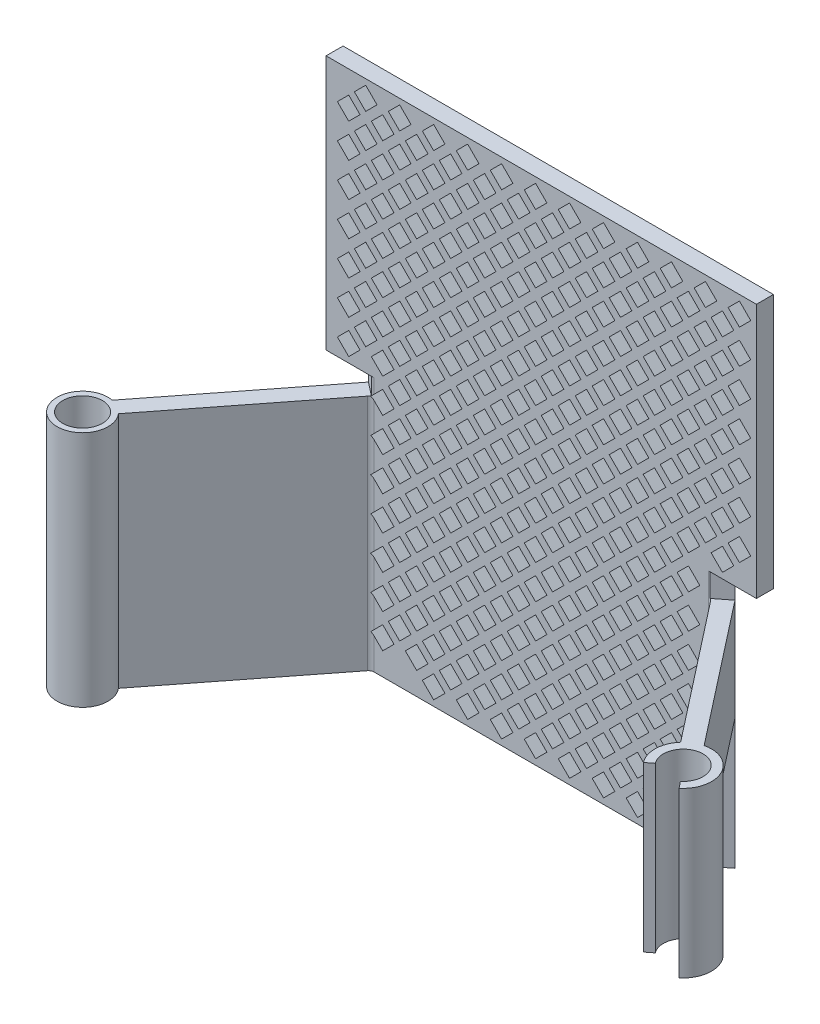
SolidWorks part; units mm, degrees
ref_plane "Plano frontal" through (0, 0, 0) normal (0, 0, 1) x (1, 0, 0)
ref_plane "Plano superior" through (0, 0, 0) normal (0, 1, 0) x (1, 0, 0)
ref_plane "Plano direito" through (0, 0, 0) normal (1, 0, 0) x (0, 0, -1)
sketch "Esboço2" plane through (0, 0, 0) normal (0, 1, 0) x (1, 0, 0)
  line L0 (0, 0) -> (0, 84) construction
  line L1 (-30, 84) -> (30, 84)
  line L2 (-29.5124, 81) -> (29.5124, 81)
  line L3 (-30, 84) -> (-30, 81) construction
  line L4 (30, 84) -> (30, 81) construction
  line L5 (30, 82.5) -> (53.033, 53.033) construction
  line L6 (30.3003, 80.6158) -> (49.279, 56.3356)
  line L8 (-30, 82.5) -> (-53.033, 53.033) construction
  line L9 (-30.3003, 80.6158) -> (-49.5929, 55.934)
  line L12 (50.2755, 50.8776) -> (49.0937, 49.9538)
  line L13 (55.2443, 50.32) -> (56.192, 49.1573)
  line L14 (30, 81) -> (32.3636, 82.8475) construction
  line L15 (32.3636, 82.8475) -> (51.8676, 57.8953)
  line L16 (-52.2101, 57.4571) -> (-32.3636, 82.8475)
  line L17 (-30, 81) -> (-32.3636, 82.8475) construction
  arc A0 (-53.033, 53.033) -> (53.033, 53.033) centre (0, 0) cw construction
  circle A1 centre (-53.033, 53.033) radius 3.5
  arc A2 (-52.2101, 57.4571) -> (-49.5929, 55.934) centre (-53.033, 53.033) ccw
  arc A3 (55.2443, 50.32) -> (50.2755, 50.8776) centre (53.033, 53.033) ccw
  arc A4 (56.192, 49.1573) -> (51.8676, 57.8953) centre (53.033, 53.033) ccw
  circle A5 centre (0, 0) radius 90 construction
  arc A6 (49.279, 56.3356) -> (49.0937, 49.9538) centre (53.033, 53.033) ccw
  arc A7 (-29.5124, 81) -> (-30.3003, 80.6158) centre (-29.5124, 80) ccw
  arc A8 (29.5124, 81) -> (30.3003, 80.6158) centre (29.5124, 80) cw
  arc A9 (-32.3636, 82.8475) -> (-30, 84) centre (-29.5124, 80) cw
  arc A10 (30, 84) -> (32.3636, 82.8475) centre (29.5124, 80) cw
  point P4 (0, 75)
  point P15 (0, 84)
  dimension "D1" = 75
  dimension "D3" = 7
  dimension "D4" = 9
  dimension "D5" = 10
  dimension "D6" = 7
  dimension "D7" = 180
  dimension "D15" = 1
  dimension "D2" = 90
  dimension "D8" = 84
  dimension "D9" = 60
  dimension "D10" = 81
  dimension "D11" = 5
  dimension "D12" = 30
  dimension "D13" = 3
  dimension "D14" = 3
  dimension "D16" = 90
extrude "Ressalto-extrusão1" add sketch "Esboço2" along normal blind 45
sketch "Esboço3" plane through (60.2872, 0, -47.1238) normal (0.7879, 0, -0.6158) x (-0.6158, 0, -0.7879)
  line L1 (45.3422, 45) -> (45.3422, 0) construction
  line L2 (45.3422, 23) -> (45.3422, 0)
  line L3 (45.3422, 0) -> (20.3422, 0)
  line L4 (45.3422, 23) -> (20.3422, 23)
  line L5 (20.3422, 23) -> (20.3422, 12)
  line L12 (20.3422, 0) -> (13.6717, 0)
  line L13 (13.6717, 0) -> (13.6717, 12)
  line L15 (13.6717, 45) -> (13.6717, 0) construction
  line L16 (13.6717, 12) -> (20.3422, 12)
  dimension "D1" = 23
  dimension "D2" = 25
  dimension "D3" = 12
extrude "Corte-extrusão1" cut sketch "Esboço3" against normal through all
sketch "Esboço4" plane through (60.2872, 0, -47.1238) normal (0.7879, 0, -0.6158) x (-0.6158, 0, -0.7879)
  line L0 (13.6717, 12) -> (4.1242, 12)
  line L1 (13.6717, 45) -> (13.6717, 12) construction
  line L2 (4.1242, 45) -> (4.1242, 0) construction
  line L3 (4.1242, 12) -> (4.1242, 0)
  line L4 (4.1242, 0) -> (13.6717, 0)
  line L5 (13.6717, 0) -> (13.6717, 12)
  line L7 (4.1242, 0) -> (13.6717, 0) construction
  dimension "D1" = 0
  dimension "D2" = 12
extrude "Corte-extrusão3" cut sketch "Esboço4" against normal mid plane 20
sketch "Esboço5" plane through (-60.2872, 0, -47.1238) normal (-0.7879, 0, -0.6158) x (-0.6158, 0, 0.7879)
  line L0 (-45.3422, 45) -> (-45.3422, 42)
  line L1 (-45.3422, 45) -> (-45.3422, 0) construction
  line L2 (-45.3422, 42) -> (-4.6231, 42)
  line L3 (-4.6231, 0) -> (-4.6231, 45) construction
  line L4 (-4.6231, 42) -> (-4.6231, 45)
  line L5 (-4.6231, 45) -> (-45.3422, 45)
  dimension "D1" = 3
extrude "Corte-extrusão4" cut sketch "Esboço5" against normal mid plane 20
sketch "Esboço6" plane through (60.2872, 0, -47.1238) normal (0.7879, 0, -0.6158) x (-0.6158, 0, -0.7879)
  line L0 (45.3422, 45) -> (4.1242, 45)
  line L1 (4.1242, 45) -> (4.1242, 41)
  line L2 (4.1242, 45) -> (4.1242, 12) construction
  line L3 (4.1242, 41) -> (45.3422, 41)
  line L4 (45.3422, 45) -> (45.3422, 23) construction
  line L5 (45.3422, 41) -> (45.3422, 45)
  dimension "D1" = 4
extrude "Corte-extrusão5" cut sketch "Esboço6" against normal mid plane 20
sketch "Esboço9" plane through (0, 45, 0) normal (0, 1, 0) x (1, 0, 0)
  line L0 (-30, 84) -> (-38, 84)
  line L1 (-29.5124, 81) -> (-38, 81)
  line L2 (-29.5124, 81) -> (29.5124, 81) construction
  line L3 (-38, 81) -> (-38, 84)
  line L4 (-30, 84) -> (30, 84)
  line L5 (30, 84) -> (38, 84)
  line L6 (-29.5124, 81) -> (38, 81)
  line L7 (38, 81) -> (38, 84)
  arc A0 (-29.5124, 81) -> (-29.9, 80.9218) centre (-29.5124, 80) ccw construction
  dimension "D1" = 8
  dimension "D2" = 8
extrude "Ressalto-extrusão2" add sketch "Esboço9" along normal blind 45
sketch "Esboço10" plane through (0, 0, -84) normal (0, 0, -1) x (-1, 0, 0)
  line L0 (-35, 89) -> (-37, 87)
  line L1 (-37, 87) -> (-35, 85)
  line L2 (-35, 85) -> (-33, 87)
  line L3 (-33, 87) -> (-35, 89)
  line L4 (-38, 90) -> (-38, 45) construction
  line L5 (-38, 90) -> (38, 90) construction
  line L6 (-35, 89) -> (-35, 85) construction
  line L7 (-31, 87) -> (-29, 85)
  line L8 (-29, 85) -> (-27, 87)
  line L9 (-27, 87) -> (-29, 89)
  line L10 (-29, 89) -> (-31, 87)
  line L11 (-25, 87) -> (-23, 85)
  line L12 (-23, 85) -> (-21, 87)
  line L13 (-21, 87) -> (-23, 89)
  line L14 (-23, 89) -> (-25, 87)
  line L15 (-19, 87) -> (-17, 85)
  line L16 (-17, 85) -> (-15, 87)
  line L17 (-15, 87) -> (-17, 89)
  line L18 (-17, 89) -> (-19, 87)
  line L19 (-13, 87) -> (-11, 85)
  line L20 (-11, 85) -> (-9, 87)
  line L21 (-9, 87) -> (-11, 89)
  line L22 (-11, 89) -> (-13, 87)
  line L23 (-7, 87) -> (-5, 85)
  line L24 (-5, 85) -> (-3, 87)
  line L25 (-3, 87) -> (-5, 89)
  line L26 (-5, 89) -> (-7, 87)
  line L27 (-1, 87) -> (1, 85)
  line L28 (1, 85) -> (3, 87)
  line L29 (3, 87) -> (1, 89)
  line L30 (1, 89) -> (-1, 87)
  line L31 (5, 87) -> (7, 85)
  line L32 (7, 85) -> (9, 87)
  line L33 (9, 87) -> (7, 89)
  line L34 (7, 89) -> (5, 87)
  line L35 (11, 87) -> (13, 85)
  line L36 (13, 85) -> (15, 87)
  line L37 (15, 87) -> (13, 89)
  line L38 (13, 89) -> (11, 87)
  line L39 (17, 87) -> (19, 85)
  line L40 (19, 85) -> (21, 87)
  line L41 (21, 87) -> (19, 89)
  line L42 (19, 89) -> (17, 87)
  line L43 (23, 87) -> (25, 85)
  line L44 (25, 85) -> (27, 87)
  line L45 (27, 87) -> (25, 89)
  line L46 (25, 89) -> (23, 87)
  line L47 (29, 87) -> (31, 85)
  line L48 (31, 85) -> (33, 87)
  line L49 (33, 87) -> (31, 89)
  line L50 (31, 89) -> (29, 87)
  line L51 (-31, 81) -> (-29, 79)
  line L52 (-29, 79) -> (-27, 81)
  line L53 (-27, 81) -> (-29, 83)
  line L54 (-29, 83) -> (-31, 81)
  line L55 (-25, 81) -> (-23, 79)
  line L56 (-23, 79) -> (-21, 81)
  line L57 (-21, 81) -> (-23, 83)
  line L58 (-23, 83) -> (-25, 81)
  line L59 (-19, 81) -> (-17, 79)
  line L60 (-17, 79) -> (-15, 81)
  line L61 (-15, 81) -> (-17, 83)
  line L62 (-17, 83) -> (-19, 81)
  line L63 (-13, 81) -> (-11, 79)
  line L64 (-11, 79) -> (-9, 81)
  line L65 (-9, 81) -> (-11, 83)
  line L66 (-11, 83) -> (-13, 81)
  line L67 (-7, 81) -> (-5, 79)
  line L68 (-5, 79) -> (-3, 81)
  line L69 (-3, 81) -> (-5, 83)
  line L70 (-5, 83) -> (-7, 81)
  line L71 (-1, 81) -> (1, 79)
  line L72 (1, 79) -> (3, 81)
  line L73 (3, 81) -> (1, 83)
  line L74 (1, 83) -> (-1, 81)
  line L75 (5, 81) -> (7, 79)
  line L76 (7, 79) -> (9, 81)
  line L77 (9, 81) -> (7, 83)
  line L78 (7, 83) -> (5, 81)
  line L79 (11, 81) -> (13, 79)
  line L80 (13, 79) -> (15, 81)
  line L81 (15, 81) -> (13, 83)
  line L82 (13, 83) -> (11, 81)
  line L83 (17, 81) -> (19, 79)
  line L84 (19, 79) -> (21, 81)
  line L85 (21, 81) -> (19, 83)
  line L86 (19, 83) -> (17, 81)
  line L87 (23, 81) -> (25, 79)
  line L88 (25, 79) -> (27, 81)
  line L89 (27, 81) -> (25, 83)
  line L90 (25, 83) -> (23, 81)
  line L91 (29, 81) -> (31, 79)
  line L92 (31, 79) -> (33, 81)
  line L93 (33, 81) -> (31, 83)
  line L94 (31, 83) -> (29, 81)
  line L95 (-31, 75) -> (-29, 73)
  line L96 (-29, 73) -> (-27, 75)
  line L97 (-27, 75) -> (-29, 77)
  line L98 (-29, 77) -> (-31, 75)
  line L99 (-25, 75) -> (-23, 73)
  line L100 (-23, 73) -> (-21, 75)
  line L101 (-21, 75) -> (-23, 77)
  line L102 (-23, 77) -> (-25, 75)
  line L103 (-19, 75) -> (-17, 73)
  line L104 (-17, 73) -> (-15, 75)
  line L105 (-15, 75) -> (-17, 77)
  line L106 (-17, 77) -> (-19, 75)
  line L107 (-13, 75) -> (-11, 73)
  line L108 (-11, 73) -> (-9, 75)
  line L109 (-9, 75) -> (-11, 77)
  line L110 (-11, 77) -> (-13, 75)
  line L111 (-7, 75) -> (-5, 73)
  line L112 (-5, 73) -> (-3, 75)
  line L113 (-3, 75) -> (-5, 77)
  line L114 (-5, 77) -> (-7, 75)
  line L115 (-1, 75) -> (1, 73)
  line L116 (1, 73) -> (3, 75)
  line L117 (3, 75) -> (1, 77)
  line L118 (1, 77) -> (-1, 75)
  line L119 (5, 75) -> (7, 73)
  line L120 (7, 73) -> (9, 75)
  line L121 (9, 75) -> (7, 77)
  line L122 (7, 77) -> (5, 75)
  line L123 (11, 75) -> (13, 73)
  line L124 (13, 73) -> (15, 75)
  line L125 (15, 75) -> (13, 77)
  line L126 (13, 77) -> (11, 75)
  line L127 (17, 75) -> (19, 73)
  line L128 (19, 73) -> (21, 75)
  line L129 (21, 75) -> (19, 77)
  line L130 (19, 77) -> (17, 75)
  line L131 (23, 75) -> (25, 73)
  line L132 (25, 73) -> (27, 75)
  line L133 (27, 75) -> (25, 77)
  line L134 (25, 77) -> (23, 75)
  line L135 (29, 75) -> (31, 73)
  line L136 (31, 73) -> (33, 75)
  line L137 (33, 75) -> (31, 77)
  line L138 (31, 77) -> (29, 75)
  line L139 (-31, 69) -> (-29, 67)
  line L140 (-29, 67) -> (-27, 69)
  line L141 (-27, 69) -> (-29, 71)
  line L142 (-29, 71) -> (-31, 69)
  line L143 (-25, 69) -> (-23, 67)
  line L144 (-23, 67) -> (-21, 69)
  line L145 (-21, 69) -> (-23, 71)
  line L146 (-23, 71) -> (-25, 69)
  line L147 (-19, 69) -> (-17, 67)
  line L148 (-17, 67) -> (-15, 69)
  line L149 (-15, 69) -> (-17, 71)
  line L150 (-17, 71) -> (-19, 69)
  line L151 (-13, 69) -> (-11, 67)
  line L152 (-11, 67) -> (-9, 69)
  line L153 (-9, 69) -> (-11, 71)
  line L154 (-11, 71) -> (-13, 69)
  line L155 (-7, 69) -> (-5, 67)
  line L156 (-5, 67) -> (-3, 69)
  line L157 (-3, 69) -> (-5, 71)
  line L158 (-5, 71) -> (-7, 69)
  line L159 (-1, 69) -> (1, 67)
  line L160 (1, 67) -> (3, 69)
  line L161 (3, 69) -> (1, 71)
  line L162 (1, 71) -> (-1, 69)
  line L163 (5, 69) -> (7, 67)
  line L164 (7, 67) -> (9, 69)
  line L165 (9, 69) -> (7, 71)
  line L166 (7, 71) -> (5, 69)
  line L167 (11, 69) -> (13, 67)
  line L168 (13, 67) -> (15, 69)
  line L169 (15, 69) -> (13, 71)
  line L170 (13, 71) -> (11, 69)
  line L171 (17, 69) -> (19, 67)
  line L172 (19, 67) -> (21, 69)
  line L173 (21, 69) -> (19, 71)
  line L174 (19, 71) -> (17, 69)
  line L175 (23, 69) -> (25, 67)
  line L176 (25, 67) -> (27, 69)
  line L177 (27, 69) -> (25, 71)
  line L178 (25, 71) -> (23, 69)
  line L179 (29, 69) -> (31, 67)
  line L180 (31, 67) -> (33, 69)
  line L181 (33, 69) -> (31, 71)
  line L182 (31, 71) -> (29, 69)
  line L183 (-31, 63) -> (-29, 61)
  line L184 (-29, 61) -> (-27, 63)
  line L185 (-27, 63) -> (-29, 65)
  line L186 (-29, 65) -> (-31, 63)
  line L187 (-25, 63) -> (-23, 61)
  line L188 (-23, 61) -> (-21, 63)
  line L189 (-21, 63) -> (-23, 65)
  line L190 (-23, 65) -> (-25, 63)
  line L191 (-19, 63) -> (-17, 61)
  line L192 (-17, 61) -> (-15, 63)
  line L193 (-15, 63) -> (-17, 65)
  line L194 (-17, 65) -> (-19, 63)
  line L195 (-13, 63) -> (-11, 61)
  line L196 (-11, 61) -> (-9, 63)
  line L197 (-9, 63) -> (-11, 65)
  line L198 (-11, 65) -> (-13, 63)
  line L199 (-7, 63) -> (-5, 61)
  line L200 (-5, 61) -> (-3, 63)
  line L201 (-3, 63) -> (-5, 65)
  line L202 (-5, 65) -> (-7, 63)
  line L203 (-1, 63) -> (1, 61)
  line L204 (1, 61) -> (3, 63)
  line L205 (3, 63) -> (1, 65)
  line L206 (1, 65) -> (-1, 63)
  line L207 (5, 63) -> (7, 61)
  line L208 (7, 61) -> (9, 63)
  line L209 (9, 63) -> (7, 65)
  line L210 (7, 65) -> (5, 63)
  line L211 (11, 63) -> (13, 61)
  line L212 (13, 61) -> (15, 63)
  line L213 (15, 63) -> (13, 65)
  line L214 (13, 65) -> (11, 63)
  line L215 (17, 63) -> (19, 61)
  line L216 (19, 61) -> (21, 63)
  line L217 (21, 63) -> (19, 65)
  line L218 (19, 65) -> (17, 63)
  line L219 (23, 63) -> (25, 61)
  line L220 (25, 61) -> (27, 63)
  line L221 (27, 63) -> (25, 65)
  line L222 (25, 65) -> (23, 63)
  line L223 (29, 63) -> (31, 61)
  line L224 (31, 61) -> (33, 63)
  line L225 (33, 63) -> (31, 65)
  line L226 (31, 65) -> (29, 63)
  line L227 (-31, 57) -> (-29, 55)
  line L228 (-29, 55) -> (-27, 57)
  line L229 (-27, 57) -> (-29, 59)
  line L230 (-29, 59) -> (-31, 57)
  line L231 (-25, 57) -> (-23, 55)
  line L232 (-23, 55) -> (-21, 57)
  line L233 (-21, 57) -> (-23, 59)
  line L234 (-23, 59) -> (-25, 57)
  line L235 (-19, 57) -> (-17, 55)
  line L236 (-17, 55) -> (-15, 57)
  line L237 (-15, 57) -> (-17, 59)
  line L238 (-17, 59) -> (-19, 57)
  line L239 (-13, 57) -> (-11, 55)
  line L240 (-11, 55) -> (-9, 57)
  line L241 (-9, 57) -> (-11, 59)
  line L242 (-11, 59) -> (-13, 57)
  line L243 (-7, 57) -> (-5, 55)
  line L244 (-5, 55) -> (-3, 57)
  line L245 (-3, 57) -> (-5, 59)
  line L246 (-5, 59) -> (-7, 57)
  line L247 (-1, 57) -> (1, 55)
  line L248 (1, 55) -> (3, 57)
  line L249 (3, 57) -> (1, 59)
  line L250 (1, 59) -> (-1, 57)
  line L251 (5, 57) -> (7, 55)
  line L252 (7, 55) -> (9, 57)
  line L253 (9, 57) -> (7, 59)
  line L254 (7, 59) -> (5, 57)
  line L255 (11, 57) -> (13, 55)
  line L256 (13, 55) -> (15, 57)
  line L257 (15, 57) -> (13, 59)
  line L258 (13, 59) -> (11, 57)
  line L259 (17, 57) -> (19, 55)
  line L260 (19, 55) -> (21, 57)
  line L261 (21, 57) -> (19, 59)
  line L262 (19, 59) -> (17, 57)
  line L263 (23, 57) -> (25, 55)
  line L264 (25, 55) -> (27, 57)
  line L265 (27, 57) -> (25, 59)
  line L266 (25, 59) -> (23, 57)
  line L267 (29, 57) -> (31, 55)
  line L268 (31, 55) -> (33, 57)
  line L269 (33, 57) -> (31, 59)
  line L270 (31, 59) -> (29, 57)
  line L271 (-31, 51) -> (-29, 49)
  line L272 (-29, 49) -> (-27, 51)
  line L273 (-27, 51) -> (-29, 53)
  line L274 (-29, 53) -> (-31, 51)
  line L275 (-25, 51) -> (-23, 49)
  line L276 (-23, 49) -> (-21, 51)
  line L277 (-21, 51) -> (-23, 53)
  line L278 (-23, 53) -> (-25, 51)
  line L279 (-19, 51) -> (-17, 49)
  line L280 (-17, 49) -> (-15, 51)
  line L281 (-15, 51) -> (-17, 53)
  line L282 (-17, 53) -> (-19, 51)
  line L283 (-13, 51) -> (-11, 49)
  line L284 (-11, 49) -> (-9, 51)
  line L285 (-9, 51) -> (-11, 53)
  line L286 (-11, 53) -> (-13, 51)
  line L287 (-7, 51) -> (-5, 49)
  line L288 (-5, 49) -> (-3, 51)
  line L289 (-3, 51) -> (-5, 53)
  line L290 (-5, 53) -> (-7, 51)
  line L291 (-1, 51) -> (1, 49)
  line L292 (1, 49) -> (3, 51)
  line L293 (3, 51) -> (1, 53)
  line L294 (1, 53) -> (-1, 51)
  line L295 (5, 51) -> (7, 49)
  line L296 (7, 49) -> (9, 51)
  line L297 (9, 51) -> (7, 53)
  line L298 (7, 53) -> (5, 51)
  line L299 (11, 51) -> (13, 49)
  line L300 (13, 49) -> (15, 51)
  line L301 (15, 51) -> (13, 53)
  line L302 (13, 53) -> (11, 51)
  line L303 (17, 51) -> (19, 49)
  line L304 (19, 49) -> (21, 51)
  line L305 (21, 51) -> (19, 53)
  line L306 (19, 53) -> (17, 51)
  line L307 (23, 51) -> (25, 49)
  line L308 (25, 49) -> (27, 51)
  line L309 (27, 51) -> (25, 53)
  line L310 (25, 53) -> (23, 51)
  line L311 (29, 51) -> (31, 49)
  line L312 (31, 49) -> (33, 51)
  line L313 (33, 51) -> (31, 53)
  line L314 (31, 53) -> (29, 51)
  line L319 (-25, 45) -> (-23, 43)
  line L320 (-23, 43) -> (-21, 45)
  line L321 (-21, 45) -> (-23, 47)
  line L322 (-23, 47) -> (-25, 45)
  line L323 (-19, 45) -> (-17, 43)
  line L324 (-17, 43) -> (-15, 45)
  line L325 (-15, 45) -> (-17, 47)
  line L326 (-17, 47) -> (-19, 45)
  line L327 (-13, 45) -> (-11, 43)
  line L328 (-11, 43) -> (-9, 45)
  line L329 (-9, 45) -> (-11, 47)
  line L330 (-11, 47) -> (-13, 45)
  line L331 (-7, 45) -> (-5, 43)
  line L332 (-5, 43) -> (-3, 45)
  line L333 (-3, 45) -> (-5, 47)
  line L334 (-5, 47) -> (-7, 45)
  line L335 (-1, 45) -> (1, 43)
  line L336 (1, 43) -> (3, 45)
  line L337 (3, 45) -> (1, 47)
  line L338 (1, 47) -> (-1, 45)
  line L339 (5, 45) -> (7, 43)
  line L340 (7, 43) -> (9, 45)
  line L341 (9, 45) -> (7, 47)
  line L342 (7, 47) -> (5, 45)
  line L343 (11, 45) -> (13, 43)
  line L344 (13, 43) -> (15, 45)
  line L345 (15, 45) -> (13, 47)
  line L346 (13, 47) -> (11, 45)
  line L347 (17, 45) -> (19, 43)
  line L348 (19, 43) -> (21, 45)
  line L349 (21, 45) -> (19, 47)
  line L350 (19, 47) -> (17, 45)
  line L351 (23, 45) -> (25, 43)
  line L352 (25, 43) -> (27, 45)
  line L353 (27, 45) -> (25, 47)
  line L354 (25, 47) -> (23, 45)
  line L363 (-25, 39) -> (-23, 37)
  line L364 (-23, 37) -> (-21, 39)
  line L365 (-21, 39) -> (-23, 41)
  line L366 (-23, 41) -> (-25, 39)
  line L367 (-19, 39) -> (-17, 37)
  line L368 (-17, 37) -> (-15, 39)
  line L369 (-15, 39) -> (-17, 41)
  line L370 (-17, 41) -> (-19, 39)
  line L371 (-13, 39) -> (-11, 37)
  line L372 (-11, 37) -> (-9, 39)
  line L373 (-9, 39) -> (-11, 41)
  line L374 (-11, 41) -> (-13, 39)
  line L375 (-7, 39) -> (-5, 37)
  line L376 (-5, 37) -> (-3, 39)
  line L377 (-3, 39) -> (-5, 41)
  line L378 (-5, 41) -> (-7, 39)
  line L379 (-1, 39) -> (1, 37)
  line L380 (1, 37) -> (3, 39)
  line L381 (3, 39) -> (1, 41)
  line L382 (1, 41) -> (-1, 39)
  line L383 (5, 39) -> (7, 37)
  line L384 (7, 37) -> (9, 39)
  line L385 (9, 39) -> (7, 41)
  line L386 (7, 41) -> (5, 39)
  line L387 (11, 39) -> (13, 37)
  line L388 (13, 37) -> (15, 39)
  line L389 (15, 39) -> (13, 41)
  line L390 (13, 41) -> (11, 39)
  line L391 (17, 39) -> (19, 37)
  line L392 (19, 37) -> (21, 39)
  line L393 (21, 39) -> (19, 41)
  line L394 (19, 41) -> (17, 39)
  line L395 (23, 39) -> (25, 37)
  line L396 (25, 37) -> (27, 39)
  line L397 (27, 39) -> (25, 41)
  line L398 (25, 41) -> (23, 39)
  line L407 (-25, 33) -> (-23, 31)
  line L408 (-23, 31) -> (-21, 33)
  line L409 (-21, 33) -> (-23, 35)
  line L410 (-23, 35) -> (-25, 33)
  line L411 (-19, 33) -> (-17, 31)
  line L412 (-17, 31) -> (-15, 33)
  line L413 (-15, 33) -> (-17, 35)
  line L414 (-17, 35) -> (-19, 33)
  line L415 (-13, 33) -> (-11, 31)
  line L416 (-11, 31) -> (-9, 33)
  line L417 (-9, 33) -> (-11, 35)
  line L418 (-11, 35) -> (-13, 33)
  line L419 (-7, 33) -> (-5, 31)
  line L420 (-5, 31) -> (-3, 33)
  line L421 (-3, 33) -> (-5, 35)
  line L422 (-5, 35) -> (-7, 33)
  line L423 (-1, 33) -> (1, 31)
  line L424 (1, 31) -> (3, 33)
  line L425 (3, 33) -> (1, 35)
  line L426 (1, 35) -> (-1, 33)
  line L427 (5, 33) -> (7, 31)
  line L428 (7, 31) -> (9, 33)
  line L429 (9, 33) -> (7, 35)
  line L430 (7, 35) -> (5, 33)
  line L431 (11, 33) -> (13, 31)
  line L432 (13, 31) -> (15, 33)
  line L433 (15, 33) -> (13, 35)
  line L434 (13, 35) -> (11, 33)
  line L435 (17, 33) -> (19, 31)
  line L436 (19, 31) -> (21, 33)
  line L437 (21, 33) -> (19, 35)
  line L438 (19, 35) -> (17, 33)
  line L439 (23, 33) -> (25, 31)
  line L440 (25, 31) -> (27, 33)
  line L441 (27, 33) -> (25, 35)
  line L442 (25, 35) -> (23, 33)
  line L447 (-37, 81) -> (-35, 79)
  line L448 (-35, 79) -> (-33, 81)
  line L449 (-33, 81) -> (-35, 83)
  line L450 (-35, 83) -> (-37, 81)
  line L451 (-37, 75) -> (-35, 73)
  line L452 (-35, 73) -> (-33, 75)
  line L453 (-33, 75) -> (-35, 77)
  line L454 (-35, 77) -> (-37, 75)
  line L455 (-37, 69) -> (-35, 67)
  line L456 (-35, 67) -> (-33, 69)
  line L457 (-33, 69) -> (-35, 71)
  line L458 (-35, 71) -> (-37, 69)
  line L459 (-37, 63) -> (-35, 61)
  line L460 (-35, 61) -> (-33, 63)
  line L461 (-33, 63) -> (-35, 65)
  line L462 (-35, 65) -> (-37, 63)
  line L463 (-37, 57) -> (-35, 55)
  line L464 (-35, 55) -> (-33, 57)
  line L465 (-33, 57) -> (-35, 59)
  line L466 (-35, 59) -> (-37, 57)
  line L467 (-37, 51) -> (-35, 49)
  line L468 (-35, 49) -> (-33, 51)
  line L469 (-33, 51) -> (-35, 53)
  line L470 (-35, 53) -> (-37, 51)
  line L483 (-35, 83) -> (-35, 85) construction
  line L484 (-33, 87) -> (-31, 87) construction
  line L485 (-31, 87) -> (-32, 87) construction
  line L486 (-32, 87) -> (-32, 99) construction
  line L487 (-32, 86) -> (-34, 84)
  line L488 (-34, 84) -> (-32, 82)
  line L489 (-32, 82) -> (-30, 84)
  line L490 (-30, 84) -> (-32, 86)
  line L491 (-24, 84) -> (-26, 86)
  line L492 (-26, 82) -> (-24, 84)
  line L493 (-26, 86) -> (-28, 84)
  line L494 (-28, 84) -> (-26, 82)
  line L495 (-18, 84) -> (-20, 86)
  line L496 (-20, 82) -> (-18, 84)
  line L497 (-20, 86) -> (-22, 84)
  line L498 (-22, 84) -> (-20, 82)
  line L499 (-12, 84) -> (-14, 86)
  line L500 (-14, 82) -> (-12, 84)
  line L501 (-14, 86) -> (-16, 84)
  line L502 (-16, 84) -> (-14, 82)
  line L503 (-6, 84) -> (-8, 86)
  line L504 (-8, 82) -> (-6, 84)
  line L505 (-8, 86) -> (-10, 84)
  line L506 (-10, 84) -> (-8, 82)
  line L507 (0, 84) -> (-2, 86)
  line L508 (-2, 82) -> (0, 84)
  line L509 (-2, 86) -> (-4, 84)
  line L510 (-4, 84) -> (-2, 82)
  line L511 (6, 84) -> (4, 86)
  line L512 (4, 82) -> (6, 84)
  line L513 (4, 86) -> (2, 84)
  line L514 (2, 84) -> (4, 82)
  line L515 (12, 84) -> (10, 86)
  line L516 (10, 82) -> (12, 84)
  line L517 (10, 86) -> (8, 84)
  line L518 (8, 84) -> (10, 82)
  line L519 (18, 84) -> (16, 86)
  line L520 (16, 82) -> (18, 84)
  line L521 (16, 86) -> (14, 84)
  line L522 (14, 84) -> (16, 82)
  line L523 (24, 84) -> (22, 86)
  line L524 (22, 82) -> (24, 84)
  line L525 (22, 86) -> (20, 84)
  line L526 (20, 84) -> (22, 82)
  line L527 (30, 84) -> (28, 86)
  line L528 (28, 82) -> (30, 84)
  line L529 (28, 86) -> (26, 84)
  line L530 (26, 84) -> (28, 82)
  line L531 (36, 84) -> (34, 86)
  line L532 (34, 82) -> (36, 84)
  line L533 (34, 86) -> (32, 84)
  line L534 (32, 84) -> (34, 82)
  line L535 (-24, 78) -> (-26, 80)
  line L536 (-26, 76) -> (-24, 78)
  line L537 (-26, 80) -> (-28, 78)
  line L538 (-28, 78) -> (-26, 76)
  line L539 (-18, 78) -> (-20, 80)
  line L540 (-20, 76) -> (-18, 78)
  line L541 (-20, 80) -> (-22, 78)
  line L542 (-22, 78) -> (-20, 76)
  line L543 (-12, 78) -> (-14, 80)
  line L544 (-14, 76) -> (-12, 78)
  line L545 (-14, 80) -> (-16, 78)
  line L546 (-16, 78) -> (-14, 76)
  line L547 (-6, 78) -> (-8, 80)
  line L548 (-8, 76) -> (-6, 78)
  line L549 (-8, 80) -> (-10, 78)
  line L550 (-10, 78) -> (-8, 76)
  line L551 (0, 78) -> (-2, 80)
  line L552 (-2, 76) -> (0, 78)
  line L553 (-2, 80) -> (-4, 78)
  line L554 (-4, 78) -> (-2, 76)
  line L555 (6, 78) -> (4, 80)
  line L556 (4, 76) -> (6, 78)
  line L557 (4, 80) -> (2, 78)
  line L558 (2, 78) -> (4, 76)
  line L559 (12, 78) -> (10, 80)
  line L560 (10, 76) -> (12, 78)
  line L561 (10, 80) -> (8, 78)
  line L562 (8, 78) -> (10, 76)
  line L563 (18, 78) -> (16, 80)
  line L564 (16, 76) -> (18, 78)
  line L565 (16, 80) -> (14, 78)
  line L566 (14, 78) -> (16, 76)
  line L567 (24, 78) -> (22, 80)
  line L568 (22, 76) -> (24, 78)
  line L569 (22, 80) -> (20, 78)
  line L570 (20, 78) -> (22, 76)
  line L571 (30, 78) -> (28, 80)
  line L572 (28, 76) -> (30, 78)
  line L573 (28, 80) -> (26, 78)
  line L574 (26, 78) -> (28, 76)
  line L575 (36, 78) -> (34, 80)
  line L576 (34, 76) -> (36, 78)
  line L577 (34, 80) -> (32, 78)
  line L578 (32, 78) -> (34, 76)
  line L579 (-24, 72) -> (-26, 74)
  line L580 (-26, 70) -> (-24, 72)
  line L581 (-26, 74) -> (-28, 72)
  line L582 (-28, 72) -> (-26, 70)
  line L583 (-18, 72) -> (-20, 74)
  line L584 (-20, 70) -> (-18, 72)
  line L585 (-20, 74) -> (-22, 72)
  line L586 (-22, 72) -> (-20, 70)
  line L587 (-12, 72) -> (-14, 74)
  line L588 (-14, 70) -> (-12, 72)
  line L589 (-14, 74) -> (-16, 72)
  line L590 (-16, 72) -> (-14, 70)
  line L591 (-6, 72) -> (-8, 74)
  line L592 (-8, 70) -> (-6, 72)
  line L593 (-8, 74) -> (-10, 72)
  line L594 (-10, 72) -> (-8, 70)
  line L595 (0, 72) -> (-2, 74)
  line L596 (-2, 70) -> (0, 72)
  line L597 (-2, 74) -> (-4, 72)
  line L598 (-4, 72) -> (-2, 70)
  line L599 (6, 72) -> (4, 74)
  line L600 (4, 70) -> (6, 72)
  line L601 (4, 74) -> (2, 72)
  line L602 (2, 72) -> (4, 70)
  line L603 (12, 72) -> (10, 74)
  line L604 (10, 70) -> (12, 72)
  line L605 (10, 74) -> (8, 72)
  line L606 (8, 72) -> (10, 70)
  line L607 (18, 72) -> (16, 74)
  line L608 (16, 70) -> (18, 72)
  line L609 (16, 74) -> (14, 72)
  line L610 (14, 72) -> (16, 70)
  line L611 (24, 72) -> (22, 74)
  line L612 (22, 70) -> (24, 72)
  line L613 (22, 74) -> (20, 72)
  line L614 (20, 72) -> (22, 70)
  line L615 (30, 72) -> (28, 74)
  line L616 (28, 70) -> (30, 72)
  line L617 (28, 74) -> (26, 72)
  line L618 (26, 72) -> (28, 70)
  line L619 (36, 72) -> (34, 74)
  line L620 (34, 70) -> (36, 72)
  line L621 (34, 74) -> (32, 72)
  line L622 (32, 72) -> (34, 70)
  line L623 (-24, 66) -> (-26, 68)
  line L624 (-26, 64) -> (-24, 66)
  line L625 (-26, 68) -> (-28, 66)
  line L626 (-28, 66) -> (-26, 64)
  line L627 (-18, 66) -> (-20, 68)
  line L628 (-20, 64) -> (-18, 66)
  line L629 (-20, 68) -> (-22, 66)
  line L630 (-22, 66) -> (-20, 64)
  line L631 (-12, 66) -> (-14, 68)
  line L632 (-14, 64) -> (-12, 66)
  line L633 (-14, 68) -> (-16, 66)
  line L634 (-16, 66) -> (-14, 64)
  line L635 (-6, 66) -> (-8, 68)
  line L636 (-8, 64) -> (-6, 66)
  line L637 (-8, 68) -> (-10, 66)
  line L638 (-10, 66) -> (-8, 64)
  line L639 (0, 66) -> (-2, 68)
  line L640 (-2, 64) -> (0, 66)
  line L641 (-2, 68) -> (-4, 66)
  line L642 (-4, 66) -> (-2, 64)
  line L643 (6, 66) -> (4, 68)
  line L644 (4, 64) -> (6, 66)
  line L645 (4, 68) -> (2, 66)
  line L646 (2, 66) -> (4, 64)
  line L647 (12, 66) -> (10, 68)
  line L648 (10, 64) -> (12, 66)
  line L649 (10, 68) -> (8, 66)
  line L650 (8, 66) -> (10, 64)
  line L651 (18, 66) -> (16, 68)
  line L652 (16, 64) -> (18, 66)
  line L653 (16, 68) -> (14, 66)
  line L654 (14, 66) -> (16, 64)
  line L655 (24, 66) -> (22, 68)
  line L656 (22, 64) -> (24, 66)
  line L657 (22, 68) -> (20, 66)
  line L658 (20, 66) -> (22, 64)
  line L659 (30, 66) -> (28, 68)
  line L660 (28, 64) -> (30, 66)
  line L661 (28, 68) -> (26, 66)
  line L662 (26, 66) -> (28, 64)
  line L663 (36, 66) -> (34, 68)
  line L664 (34, 64) -> (36, 66)
  line L665 (34, 68) -> (32, 66)
  line L666 (32, 66) -> (34, 64)
  line L667 (-24, 60) -> (-26, 62)
  line L668 (-26, 58) -> (-24, 60)
  line L669 (-26, 62) -> (-28, 60)
  line L670 (-28, 60) -> (-26, 58)
  line L671 (-18, 60) -> (-20, 62)
  line L672 (-20, 58) -> (-18, 60)
  line L673 (-20, 62) -> (-22, 60)
  line L674 (-22, 60) -> (-20, 58)
  line L675 (-12, 60) -> (-14, 62)
  line L676 (-14, 58) -> (-12, 60)
  line L677 (-14, 62) -> (-16, 60)
  line L678 (-16, 60) -> (-14, 58)
  line L679 (-6, 60) -> (-8, 62)
  line L680 (-8, 58) -> (-6, 60)
  line L681 (-8, 62) -> (-10, 60)
  line L682 (-10, 60) -> (-8, 58)
  line L683 (0, 60) -> (-2, 62)
  line L684 (-2, 58) -> (0, 60)
  line L685 (-2, 62) -> (-4, 60)
  line L686 (-4, 60) -> (-2, 58)
  line L687 (6, 60) -> (4, 62)
  line L688 (4, 58) -> (6, 60)
  line L689 (4, 62) -> (2, 60)
  line L690 (2, 60) -> (4, 58)
  line L691 (12, 60) -> (10, 62)
  line L692 (10, 58) -> (12, 60)
  line L693 (10, 62) -> (8, 60)
  line L694 (8, 60) -> (10, 58)
  line L695 (18, 60) -> (16, 62)
  line L696 (16, 58) -> (18, 60)
  line L697 (16, 62) -> (14, 60)
  line L698 (14, 60) -> (16, 58)
  line L699 (24, 60) -> (22, 62)
  line L700 (22, 58) -> (24, 60)
  line L701 (22, 62) -> (20, 60)
  line L702 (20, 60) -> (22, 58)
  line L703 (30, 60) -> (28, 62)
  line L704 (28, 58) -> (30, 60)
  line L705 (28, 62) -> (26, 60)
  line L706 (26, 60) -> (28, 58)
  line L707 (36, 60) -> (34, 62)
  line L708 (34, 58) -> (36, 60)
  line L709 (34, 62) -> (32, 60)
  line L710 (32, 60) -> (34, 58)
  line L711 (-24, 54) -> (-26, 56)
  line L712 (-26, 52) -> (-24, 54)
  line L713 (-26, 56) -> (-28, 54)
  line L714 (-28, 54) -> (-26, 52)
  line L715 (-18, 54) -> (-20, 56)
  line L716 (-20, 52) -> (-18, 54)
  line L717 (-20, 56) -> (-22, 54)
  line L718 (-22, 54) -> (-20, 52)
  line L719 (-12, 54) -> (-14, 56)
  line L720 (-14, 52) -> (-12, 54)
  line L721 (-14, 56) -> (-16, 54)
  line L722 (-16, 54) -> (-14, 52)
  line L723 (-6, 54) -> (-8, 56)
  line L724 (-8, 52) -> (-6, 54)
  line L725 (-8, 56) -> (-10, 54)
  line L726 (-10, 54) -> (-8, 52)
  line L727 (0, 54) -> (-2, 56)
  line L728 (-2, 52) -> (0, 54)
  line L729 (-2, 56) -> (-4, 54)
  line L730 (-4, 54) -> (-2, 52)
  line L731 (6, 54) -> (4, 56)
  line L732 (4, 52) -> (6, 54)
  line L733 (4, 56) -> (2, 54)
  line L734 (2, 54) -> (4, 52)
  line L735 (12, 54) -> (10, 56)
  line L736 (10, 52) -> (12, 54)
  line L737 (10, 56) -> (8, 54)
  line L738 (8, 54) -> (10, 52)
  line L739 (18, 54) -> (16, 56)
  line L740 (16, 52) -> (18, 54)
  line L741 (16, 56) -> (14, 54)
  line L742 (14, 54) -> (16, 52)
  line L743 (24, 54) -> (22, 56)
  line L744 (22, 52) -> (24, 54)
  line L745 (22, 56) -> (20, 54)
  line L746 (20, 54) -> (22, 52)
  line L747 (30, 54) -> (28, 56)
  line L748 (28, 52) -> (30, 54)
  line L749 (28, 56) -> (26, 54)
  line L750 (26, 54) -> (28, 52)
  line L751 (36, 54) -> (34, 56)
  line L752 (34, 52) -> (36, 54)
  line L753 (34, 56) -> (32, 54)
  line L754 (32, 54) -> (34, 52)
  line L755 (-24, 48) -> (-26, 50)
  line L756 (-26, 46) -> (-24, 48)
  line L757 (-26, 50) -> (-28, 48)
  line L758 (-28, 48) -> (-26, 46)
  line L759 (-18, 48) -> (-20, 50)
  line L760 (-20, 46) -> (-18, 48)
  line L761 (-20, 50) -> (-22, 48)
  line L762 (-22, 48) -> (-20, 46)
  line L763 (-12, 48) -> (-14, 50)
  line L764 (-14, 46) -> (-12, 48)
  line L765 (-14, 50) -> (-16, 48)
  line L766 (-16, 48) -> (-14, 46)
  line L767 (-6, 48) -> (-8, 50)
  line L768 (-8, 46) -> (-6, 48)
  line L769 (-8, 50) -> (-10, 48)
  line L770 (-10, 48) -> (-8, 46)
  line L771 (0, 48) -> (-2, 50)
  line L772 (-2, 46) -> (0, 48)
  line L773 (-2, 50) -> (-4, 48)
  line L774 (-4, 48) -> (-2, 46)
  line L775 (6, 48) -> (4, 50)
  line L776 (4, 46) -> (6, 48)
  line L777 (4, 50) -> (2, 48)
  line L778 (2, 48) -> (4, 46)
  line L779 (12, 48) -> (10, 50)
  line L780 (10, 46) -> (12, 48)
  line L781 (10, 50) -> (8, 48)
  line L782 (8, 48) -> (10, 46)
  line L783 (18, 48) -> (16, 50)
  line L784 (16, 46) -> (18, 48)
  line L785 (16, 50) -> (14, 48)
  line L786 (14, 48) -> (16, 46)
  line L787 (24, 48) -> (22, 50)
  line L788 (22, 46) -> (24, 48)
  line L789 (22, 50) -> (20, 48)
  line L790 (20, 48) -> (22, 46)
  line L791 (30, 48) -> (28, 50)
  line L792 (28, 46) -> (30, 48)
  line L793 (28, 50) -> (26, 48)
  line L794 (26, 48) -> (28, 46)
  line L795 (36, 48) -> (34, 50)
  line L796 (34, 46) -> (36, 48)
  line L797 (34, 50) -> (32, 48)
  line L798 (32, 48) -> (34, 46)
  line L799 (-24, 42) -> (-26, 44)
  line L800 (-26, 40) -> (-24, 42)
  line L801 (-26, 44) -> (-28, 42)
  line L802 (-28, 42) -> (-26, 40)
  line L803 (-18, 42) -> (-20, 44)
  line L804 (-20, 40) -> (-18, 42)
  line L805 (-20, 44) -> (-22, 42)
  line L806 (-22, 42) -> (-20, 40)
  line L807 (-12, 42) -> (-14, 44)
  line L808 (-14, 40) -> (-12, 42)
  line L809 (-14, 44) -> (-16, 42)
  line L810 (-16, 42) -> (-14, 40)
  line L811 (-6, 42) -> (-8, 44)
  line L812 (-8, 40) -> (-6, 42)
  line L813 (-8, 44) -> (-10, 42)
  line L814 (-10, 42) -> (-8, 40)
  line L815 (0, 42) -> (-2, 44)
  line L816 (-2, 40) -> (0, 42)
  line L817 (-2, 44) -> (-4, 42)
  line L818 (-4, 42) -> (-2, 40)
  line L819 (6, 42) -> (4, 44)
  line L820 (4, 40) -> (6, 42)
  line L821 (4, 44) -> (2, 42)
  line L822 (2, 42) -> (4, 40)
  line L823 (12, 42) -> (10, 44)
  line L824 (10, 40) -> (12, 42)
  line L825 (10, 44) -> (8, 42)
  line L826 (8, 42) -> (10, 40)
  line L827 (18, 42) -> (16, 44)
  line L828 (16, 40) -> (18, 42)
  line L829 (16, 44) -> (14, 42)
  line L830 (14, 42) -> (16, 40)
  line L831 (24, 42) -> (22, 44)
  line L832 (22, 40) -> (24, 42)
  line L833 (22, 44) -> (20, 42)
  line L834 (20, 42) -> (22, 40)
  line L835 (30, 42) -> (28, 44)
  line L836 (28, 40) -> (30, 42)
  line L837 (28, 44) -> (26, 42)
  line L838 (26, 42) -> (28, 40)
  line L843 (-24, 36) -> (-26, 38)
  line L844 (-26, 34) -> (-24, 36)
  line L845 (-26, 38) -> (-28, 36)
  line L846 (-28, 36) -> (-26, 34)
  line L847 (-18, 36) -> (-20, 38)
  line L848 (-20, 34) -> (-18, 36)
  line L849 (-20, 38) -> (-22, 36)
  line L850 (-22, 36) -> (-20, 34)
  line L851 (-12, 36) -> (-14, 38)
  line L852 (-14, 34) -> (-12, 36)
  line L853 (-14, 38) -> (-16, 36)
  line L854 (-16, 36) -> (-14, 34)
  line L855 (-6, 36) -> (-8, 38)
  line L856 (-8, 34) -> (-6, 36)
  line L857 (-8, 38) -> (-10, 36)
  line L858 (-10, 36) -> (-8, 34)
  line L859 (0, 36) -> (-2, 38)
  line L860 (-2, 34) -> (0, 36)
  line L861 (-2, 38) -> (-4, 36)
  line L862 (-4, 36) -> (-2, 34)
  line L863 (6, 36) -> (4, 38)
  line L864 (4, 34) -> (6, 36)
  line L865 (4, 38) -> (2, 36)
  line L866 (2, 36) -> (4, 34)
  line L867 (12, 36) -> (10, 38)
  line L868 (10, 34) -> (12, 36)
  line L869 (10, 38) -> (8, 36)
  line L870 (8, 36) -> (10, 34)
  line L871 (18, 36) -> (16, 38)
  line L872 (16, 34) -> (18, 36)
  line L873 (16, 38) -> (14, 36)
  line L874 (14, 36) -> (16, 34)
  line L875 (24, 36) -> (22, 38)
  line L876 (22, 34) -> (24, 36)
  line L877 (22, 38) -> (20, 36)
  line L878 (20, 36) -> (22, 34)
  line L879 (30, 36) -> (28, 38)
  line L880 (28, 34) -> (30, 36)
  line L881 (28, 38) -> (26, 36)
  line L882 (26, 36) -> (28, 34)
  line L887 (-30, 78) -> (-32, 80)
  line L888 (-32, 76) -> (-30, 78)
  line L889 (-32, 80) -> (-34, 78)
  line L890 (-34, 78) -> (-32, 76)
  line L891 (-30, 72) -> (-32, 74)
  line L892 (-32, 70) -> (-30, 72)
  line L893 (-32, 74) -> (-34, 72)
  line L894 (-34, 72) -> (-32, 70)
  line L895 (-30, 66) -> (-32, 68)
  line L896 (-32, 64) -> (-30, 66)
  line L897 (-32, 68) -> (-34, 66)
  line L898 (-34, 66) -> (-32, 64)
  line L899 (-30, 60) -> (-32, 62)
  line L900 (-32, 58) -> (-30, 60)
  line L901 (-32, 62) -> (-34, 60)
  line L902 (-34, 60) -> (-32, 58)
  line L903 (-30, 54) -> (-32, 56)
  line L904 (-32, 52) -> (-30, 54)
  line L905 (-32, 56) -> (-34, 54)
  line L906 (-34, 54) -> (-32, 52)
  line L907 (-30, 48) -> (-32, 50)
  line L908 (-32, 46) -> (-30, 48)
  line L909 (-32, 50) -> (-34, 48)
  line L910 (-34, 48) -> (-32, 46)
  line L919 (-19, 33) -> (-17, 31)
  line L920 (-17, 31) -> (-15, 33)
  line L921 (-15, 33) -> (-17, 35)
  line L922 (-17, 35) -> (-19, 33)
  line L923 (-13, 33) -> (-11, 31)
  line L924 (-11, 31) -> (-9, 33)
  line L925 (-9, 33) -> (-11, 35)
  line L926 (-11, 35) -> (-13, 33)
  line L927 (-7, 33) -> (-5, 31)
  line L928 (-5, 31) -> (-3, 33)
  line L929 (-3, 33) -> (-5, 35)
  line L930 (-5, 35) -> (-7, 33)
  line L931 (-1, 33) -> (1, 31)
  line L932 (1, 31) -> (3, 33)
  line L933 (3, 33) -> (1, 35)
  line L934 (1, 35) -> (-1, 33)
  line L935 (5, 33) -> (7, 31)
  line L936 (7, 31) -> (9, 33)
  line L937 (9, 33) -> (7, 35)
  line L938 (7, 35) -> (5, 33)
  line L939 (11, 33) -> (13, 31)
  line L940 (13, 31) -> (15, 33)
  line L941 (15, 33) -> (13, 35)
  line L942 (13, 35) -> (11, 33)
  line L943 (17, 33) -> (19, 31)
  line L944 (19, 31) -> (21, 33)
  line L945 (21, 33) -> (19, 35)
  line L946 (19, 35) -> (17, 33)
  line L947 (23, 33) -> (25, 31)
  line L948 (25, 31) -> (27, 33)
  line L949 (27, 33) -> (25, 35)
  line L950 (25, 35) -> (23, 33)
  line L951 (-19, 27) -> (-17, 25)
  line L952 (-17, 25) -> (-15, 27)
  line L953 (-15, 27) -> (-17, 29)
  line L954 (-17, 29) -> (-19, 27)
  line L955 (-13, 27) -> (-11, 25)
  line L956 (-11, 25) -> (-9, 27)
  line L957 (-9, 27) -> (-11, 29)
  line L958 (-11, 29) -> (-13, 27)
  line L959 (-7, 27) -> (-5, 25)
  line L960 (-5, 25) -> (-3, 27)
  line L961 (-3, 27) -> (-5, 29)
  line L962 (-5, 29) -> (-7, 27)
  line L963 (-1, 27) -> (1, 25)
  line L964 (1, 25) -> (3, 27)
  line L965 (3, 27) -> (1, 29)
  line L966 (1, 29) -> (-1, 27)
  line L967 (5, 27) -> (7, 25)
  line L968 (7, 25) -> (9, 27)
  line L969 (9, 27) -> (7, 29)
  line L970 (7, 29) -> (5, 27)
  line L971 (11, 27) -> (13, 25)
  line L972 (13, 25) -> (15, 27)
  line L973 (15, 27) -> (13, 29)
  line L974 (13, 29) -> (11, 27)
  line L975 (17, 27) -> (19, 25)
  line L976 (19, 25) -> (21, 27)
  line L977 (21, 27) -> (19, 29)
  line L978 (19, 29) -> (17, 27)
  line L979 (23, 27) -> (25, 25)
  line L980 (25, 25) -> (27, 27)
  line L981 (27, 27) -> (25, 29)
  line L982 (25, 29) -> (23, 27)
  line L983 (-19, 21) -> (-17, 19)
  line L984 (-17, 19) -> (-15, 21)
  line L985 (-15, 21) -> (-17, 23)
  line L986 (-17, 23) -> (-19, 21)
  line L987 (-13, 21) -> (-11, 19)
  line L988 (-11, 19) -> (-9, 21)
  line L989 (-9, 21) -> (-11, 23)
  line L990 (-11, 23) -> (-13, 21)
  line L991 (-7, 21) -> (-5, 19)
  line L992 (-5, 19) -> (-3, 21)
  line L993 (-3, 21) -> (-5, 23)
  line L994 (-5, 23) -> (-7, 21)
  line L995 (-1, 21) -> (1, 19)
  line L996 (1, 19) -> (3, 21)
  line L997 (3, 21) -> (1, 23)
  line L998 (1, 23) -> (-1, 21)
  line L999 (5, 21) -> (7, 19)
  line L1000 (7, 19) -> (9, 21)
  line L1001 (9, 21) -> (7, 23)
  line L1002 (7, 23) -> (5, 21)
  line L1003 (11, 21) -> (13, 19)
  line L1004 (13, 19) -> (15, 21)
  line L1005 (15, 21) -> (13, 23)
  line L1006 (13, 23) -> (11, 21)
  line L1007 (17, 21) -> (19, 19)
  line L1008 (19, 19) -> (21, 21)
  line L1009 (21, 21) -> (19, 23)
  line L1010 (19, 23) -> (17, 21)
  line L1011 (23, 21) -> (25, 19)
  line L1012 (25, 19) -> (27, 21)
  line L1013 (27, 21) -> (25, 23)
  line L1014 (25, 23) -> (23, 21)
  line L1015 (-19, 15) -> (-17, 13)
  line L1016 (-17, 13) -> (-15, 15)
  line L1017 (-15, 15) -> (-17, 17)
  line L1018 (-17, 17) -> (-19, 15)
  line L1019 (-13, 15) -> (-11, 13)
  line L1020 (-11, 13) -> (-9, 15)
  line L1021 (-9, 15) -> (-11, 17)
  line L1022 (-11, 17) -> (-13, 15)
  line L1023 (-7, 15) -> (-5, 13)
  line L1024 (-5, 13) -> (-3, 15)
  line L1025 (-3, 15) -> (-5, 17)
  line L1026 (-5, 17) -> (-7, 15)
  line L1027 (-1, 15) -> (1, 13)
  line L1028 (1, 13) -> (3, 15)
  line L1029 (3, 15) -> (1, 17)
  line L1030 (1, 17) -> (-1, 15)
  line L1031 (5, 15) -> (7, 13)
  line L1032 (7, 13) -> (9, 15)
  line L1033 (9, 15) -> (7, 17)
  line L1034 (7, 17) -> (5, 15)
  line L1035 (11, 15) -> (13, 13)
  line L1036 (13, 13) -> (15, 15)
  line L1037 (15, 15) -> (13, 17)
  line L1038 (13, 17) -> (11, 15)
  line L1039 (17, 15) -> (19, 13)
  line L1040 (19, 13) -> (21, 15)
  line L1041 (21, 15) -> (19, 17)
  line L1042 (19, 17) -> (17, 15)
  line L1043 (23, 15) -> (25, 13)
  line L1044 (25, 13) -> (27, 15)
  line L1045 (27, 15) -> (25, 17)
  line L1046 (25, 17) -> (23, 15)
  line L1047 (-19, 9) -> (-17, 7)
  line L1048 (-17, 7) -> (-15, 9)
  line L1049 (-15, 9) -> (-17, 11)
  line L1050 (-17, 11) -> (-19, 9)
  line L1051 (-13, 9) -> (-11, 7)
  line L1052 (-11, 7) -> (-9, 9)
  line L1053 (-9, 9) -> (-11, 11)
  line L1054 (-11, 11) -> (-13, 9)
  line L1055 (-7, 9) -> (-5, 7)
  line L1056 (-5, 7) -> (-3, 9)
  line L1057 (-3, 9) -> (-5, 11)
  line L1058 (-5, 11) -> (-7, 9)
  line L1059 (-1, 9) -> (1, 7)
  line L1060 (1, 7) -> (3, 9)
  line L1061 (3, 9) -> (1, 11)
  line L1062 (1, 11) -> (-1, 9)
  line L1063 (5, 9) -> (7, 7)
  line L1064 (7, 7) -> (9, 9)
  line L1065 (9, 9) -> (7, 11)
  line L1066 (7, 11) -> (5, 9)
  line L1067 (11, 9) -> (13, 7)
  line L1068 (13, 7) -> (15, 9)
  line L1069 (15, 9) -> (13, 11)
  line L1070 (13, 11) -> (11, 9)
  line L1071 (17, 9) -> (19, 7)
  line L1072 (19, 7) -> (21, 9)
  line L1073 (21, 9) -> (19, 11)
  line L1074 (19, 11) -> (17, 9)
  line L1075 (23, 9) -> (25, 7)
  line L1076 (25, 7) -> (27, 9)
  line L1077 (27, 9) -> (25, 11)
  line L1078 (25, 11) -> (23, 9)
  line L1079 (-19, 3) -> (-17, 1)
  line L1080 (-17, 1) -> (-15, 3)
  line L1081 (-15, 3) -> (-17, 5)
  line L1082 (-17, 5) -> (-19, 3)
  line L1083 (-13, 3) -> (-11, 1)
  line L1084 (-11, 1) -> (-9, 3)
  line L1085 (-9, 3) -> (-11, 5)
  line L1086 (-11, 5) -> (-13, 3)
  line L1087 (-7, 3) -> (-5, 1)
  line L1088 (-5, 1) -> (-3, 3)
  line L1089 (-3, 3) -> (-5, 5)
  line L1090 (-5, 5) -> (-7, 3)
  line L1091 (-1, 3) -> (1, 1)
  line L1092 (1, 1) -> (3, 3)
  line L1093 (3, 3) -> (1, 5)
  line L1094 (1, 5) -> (-1, 3)
  line L1095 (5, 3) -> (7, 1)
  line L1096 (7, 1) -> (9, 3)
  line L1097 (9, 3) -> (7, 5)
  line L1098 (7, 5) -> (5, 3)
  line L1099 (11, 3) -> (13, 1)
  line L1100 (13, 1) -> (15, 3)
  line L1101 (15, 3) -> (13, 5)
  line L1102 (13, 5) -> (11, 3)
  line L1103 (17, 3) -> (19, 1)
  line L1104 (19, 1) -> (21, 3)
  line L1105 (21, 3) -> (19, 5)
  line L1106 (19, 5) -> (17, 3)
  line L1175 (-25, 27) -> (-23, 25)
  line L1176 (-23, 25) -> (-21, 27)
  line L1177 (-21, 27) -> (-23, 29)
  line L1178 (-23, 29) -> (-25, 27)
  line L1179 (-25, 21) -> (-23, 19)
  line L1180 (-23, 19) -> (-21, 21)
  line L1181 (-21, 21) -> (-23, 23)
  line L1182 (-23, 23) -> (-25, 21)
  line L1183 (-25, 15) -> (-23, 13)
  line L1184 (-23, 13) -> (-21, 15)
  line L1185 (-21, 15) -> (-23, 17)
  line L1186 (-23, 17) -> (-25, 15)
  line L1187 (-25, 9) -> (-23, 7)
  line L1188 (-23, 7) -> (-21, 9)
  line L1189 (-21, 9) -> (-23, 11)
  line L1190 (-23, 11) -> (-25, 9)
  line L1191 (-25, 3) -> (-23, 1)
  line L1192 (-23, 1) -> (-21, 3)
  line L1193 (-21, 3) -> (-23, 5)
  line L1194 (-23, 5) -> (-25, 3)
  line L1203 (-22, 36) -> (-20, 34)
  line L1204 (-20, 34) -> (-18, 36)
  line L1205 (-18, 36) -> (-20, 38)
  line L1206 (-20, 38) -> (-22, 36)
  line L1207 (-16, 36) -> (-14, 34)
  line L1208 (-14, 34) -> (-12, 36)
  line L1209 (-12, 36) -> (-14, 38)
  line L1210 (-14, 38) -> (-16, 36)
  line L1211 (-10, 36) -> (-8, 34)
  line L1212 (-8, 34) -> (-6, 36)
  line L1213 (-6, 36) -> (-8, 38)
  line L1214 (-8, 38) -> (-10, 36)
  line L1215 (-4, 36) -> (-2, 34)
  line L1216 (-2, 34) -> (0, 36)
  line L1217 (0, 36) -> (-2, 38)
  line L1218 (-2, 38) -> (-4, 36)
  line L1219 (2, 36) -> (4, 34)
  line L1220 (4, 34) -> (6, 36)
  line L1221 (6, 36) -> (4, 38)
  line L1222 (4, 38) -> (2, 36)
  line L1223 (8, 36) -> (10, 34)
  line L1224 (10, 34) -> (12, 36)
  line L1225 (12, 36) -> (10, 38)
  line L1226 (10, 38) -> (8, 36)
  line L1227 (14, 36) -> (16, 34)
  line L1228 (16, 34) -> (18, 36)
  line L1229 (18, 36) -> (16, 38)
  line L1230 (16, 38) -> (14, 36)
  line L1231 (20, 36) -> (22, 34)
  line L1232 (22, 34) -> (24, 36)
  line L1233 (24, 36) -> (22, 38)
  line L1234 (22, 38) -> (20, 36)
  line L1235 (26, 36) -> (28, 34)
  line L1236 (28, 34) -> (30, 36)
  line L1237 (30, 36) -> (28, 38)
  line L1238 (28, 38) -> (26, 36)
  line L1239 (-22, 30) -> (-20, 28)
  line L1240 (-20, 28) -> (-18, 30)
  line L1241 (-18, 30) -> (-20, 32)
  line L1242 (-20, 32) -> (-22, 30)
  line L1243 (-16, 30) -> (-14, 28)
  line L1244 (-14, 28) -> (-12, 30)
  line L1245 (-12, 30) -> (-14, 32)
  line L1246 (-14, 32) -> (-16, 30)
  line L1247 (-10, 30) -> (-8, 28)
  line L1248 (-8, 28) -> (-6, 30)
  line L1249 (-6, 30) -> (-8, 32)
  line L1250 (-8, 32) -> (-10, 30)
  line L1251 (-4, 30) -> (-2, 28)
  line L1252 (-2, 28) -> (0, 30)
  line L1253 (0, 30) -> (-2, 32)
  line L1254 (-2, 32) -> (-4, 30)
  line L1255 (2, 30) -> (4, 28)
  line L1256 (4, 28) -> (6, 30)
  line L1257 (6, 30) -> (4, 32)
  line L1258 (4, 32) -> (2, 30)
  line L1259 (8, 30) -> (10, 28)
  line L1260 (10, 28) -> (12, 30)
  line L1261 (12, 30) -> (10, 32)
  line L1262 (10, 32) -> (8, 30)
  line L1263 (14, 30) -> (16, 28)
  line L1264 (16, 28) -> (18, 30)
  line L1265 (18, 30) -> (16, 32)
  line L1266 (16, 32) -> (14, 30)
  line L1267 (20, 30) -> (22, 28)
  line L1268 (22, 28) -> (24, 30)
  line L1269 (24, 30) -> (22, 32)
  line L1270 (22, 32) -> (20, 30)
  line L1271 (26, 30) -> (28, 28)
  line L1272 (28, 28) -> (30, 30)
  line L1273 (30, 30) -> (28, 32)
  line L1274 (28, 32) -> (26, 30)
  line L1275 (-22, 24) -> (-20, 22)
  line L1276 (-20, 22) -> (-18, 24)
  line L1277 (-18, 24) -> (-20, 26)
  line L1278 (-20, 26) -> (-22, 24)
  line L1279 (-16, 24) -> (-14, 22)
  line L1280 (-14, 22) -> (-12, 24)
  line L1281 (-12, 24) -> (-14, 26)
  line L1282 (-14, 26) -> (-16, 24)
  line L1283 (-10, 24) -> (-8, 22)
  line L1284 (-8, 22) -> (-6, 24)
  line L1285 (-6, 24) -> (-8, 26)
  line L1286 (-8, 26) -> (-10, 24)
  line L1287 (-4, 24) -> (-2, 22)
  line L1288 (-2, 22) -> (0, 24)
  line L1289 (0, 24) -> (-2, 26)
  line L1290 (-2, 26) -> (-4, 24)
  line L1291 (2, 24) -> (4, 22)
  line L1292 (4, 22) -> (6, 24)
  line L1293 (6, 24) -> (4, 26)
  line L1294 (4, 26) -> (2, 24)
  line L1295 (8, 24) -> (10, 22)
  line L1296 (10, 22) -> (12, 24)
  line L1297 (12, 24) -> (10, 26)
  line L1298 (10, 26) -> (8, 24)
  line L1299 (14, 24) -> (16, 22)
  line L1300 (16, 22) -> (18, 24)
  line L1301 (18, 24) -> (16, 26)
  line L1302 (16, 26) -> (14, 24)
  line L1303 (20, 24) -> (22, 22)
  line L1304 (22, 22) -> (24, 24)
  line L1305 (24, 24) -> (22, 26)
  line L1306 (22, 26) -> (20, 24)
  line L1307 (26, 24) -> (28, 22)
  line L1308 (28, 22) -> (30, 24)
  line L1309 (30, 24) -> (28, 26)
  line L1310 (28, 26) -> (26, 24)
  line L1311 (-22, 18) -> (-20, 16)
  line L1312 (-20, 16) -> (-18, 18)
  line L1313 (-18, 18) -> (-20, 20)
  line L1314 (-20, 20) -> (-22, 18)
  line L1315 (-16, 18) -> (-14, 16)
  line L1316 (-14, 16) -> (-12, 18)
  line L1317 (-12, 18) -> (-14, 20)
  line L1318 (-14, 20) -> (-16, 18)
  line L1319 (-10, 18) -> (-8, 16)
  line L1320 (-8, 16) -> (-6, 18)
  line L1321 (-6, 18) -> (-8, 20)
  line L1322 (-8, 20) -> (-10, 18)
  line L1323 (-4, 18) -> (-2, 16)
  line L1324 (-2, 16) -> (0, 18)
  line L1325 (0, 18) -> (-2, 20)
  line L1326 (-2, 20) -> (-4, 18)
  line L1327 (2, 18) -> (4, 16)
  line L1328 (4, 16) -> (6, 18)
  line L1329 (6, 18) -> (4, 20)
  line L1330 (4, 20) -> (2, 18)
  line L1331 (8, 18) -> (10, 16)
  line L1332 (10, 16) -> (12, 18)
  line L1333 (12, 18) -> (10, 20)
  line L1334 (10, 20) -> (8, 18)
  line L1335 (14, 18) -> (16, 16)
  line L1336 (16, 16) -> (18, 18)
  line L1337 (18, 18) -> (16, 20)
  line L1338 (16, 20) -> (14, 18)
  line L1339 (20, 18) -> (22, 16)
  line L1340 (22, 16) -> (24, 18)
  line L1341 (24, 18) -> (22, 20)
  line L1342 (22, 20) -> (20, 18)
  line L1343 (26, 18) -> (28, 16)
  line L1344 (28, 16) -> (30, 18)
  line L1345 (30, 18) -> (28, 20)
  line L1346 (28, 20) -> (26, 18)
  line L1347 (-22, 12) -> (-20, 10)
  line L1348 (-20, 10) -> (-18, 12)
  line L1349 (-18, 12) -> (-20, 14)
  line L1350 (-20, 14) -> (-22, 12)
  line L1351 (-16, 12) -> (-14, 10)
  line L1352 (-14, 10) -> (-12, 12)
  line L1353 (-12, 12) -> (-14, 14)
  line L1354 (-14, 14) -> (-16, 12)
  line L1355 (-10, 12) -> (-8, 10)
  line L1356 (-8, 10) -> (-6, 12)
  line L1357 (-6, 12) -> (-8, 14)
  line L1358 (-8, 14) -> (-10, 12)
  line L1359 (-4, 12) -> (-2, 10)
  line L1360 (-2, 10) -> (0, 12)
  line L1361 (0, 12) -> (-2, 14)
  line L1362 (-2, 14) -> (-4, 12)
  line L1363 (2, 12) -> (4, 10)
  line L1364 (4, 10) -> (6, 12)
  line L1365 (6, 12) -> (4, 14)
  line L1366 (4, 14) -> (2, 12)
  line L1367 (8, 12) -> (10, 10)
  line L1368 (10, 10) -> (12, 12)
  line L1369 (12, 12) -> (10, 14)
  line L1370 (10, 14) -> (8, 12)
  line L1371 (14, 12) -> (16, 10)
  line L1372 (16, 10) -> (18, 12)
  line L1373 (18, 12) -> (16, 14)
  line L1374 (16, 14) -> (14, 12)
  line L1375 (20, 12) -> (22, 10)
  line L1376 (22, 10) -> (24, 12)
  line L1377 (24, 12) -> (22, 14)
  line L1378 (22, 14) -> (20, 12)
  line L1379 (26, 12) -> (28, 10)
  line L1380 (28, 10) -> (30, 12)
  line L1381 (30, 12) -> (28, 14)
  line L1382 (28, 14) -> (26, 12)
  line L1383 (-22, 6) -> (-20, 4)
  line L1384 (-20, 4) -> (-18, 6)
  line L1385 (-18, 6) -> (-20, 8)
  line L1386 (-20, 8) -> (-22, 6)
  line L1387 (-16, 6) -> (-14, 4)
  line L1388 (-14, 4) -> (-12, 6)
  line L1389 (-12, 6) -> (-14, 8)
  line L1390 (-14, 8) -> (-16, 6)
  line L1391 (-10, 6) -> (-8, 4)
  line L1392 (-8, 4) -> (-6, 6)
  line L1393 (-6, 6) -> (-8, 8)
  line L1394 (-8, 8) -> (-10, 6)
  line L1395 (-4, 6) -> (-2, 4)
  line L1396 (-2, 4) -> (0, 6)
  line L1397 (0, 6) -> (-2, 8)
  line L1398 (-2, 8) -> (-4, 6)
  line L1399 (2, 6) -> (4, 4)
  line L1400 (4, 4) -> (6, 6)
  line L1401 (6, 6) -> (4, 8)
  line L1402 (4, 8) -> (2, 6)
  line L1403 (8, 6) -> (10, 4)
  line L1404 (10, 4) -> (12, 6)
  line L1405 (12, 6) -> (10, 8)
  line L1406 (10, 8) -> (8, 6)
  line L1407 (14, 6) -> (16, 4)
  line L1408 (16, 4) -> (18, 6)
  line L1409 (18, 6) -> (16, 8)
  line L1410 (16, 8) -> (14, 6)
  line L1411 (20, 6) -> (22, 4)
  line L1412 (22, 4) -> (24, 6)
  line L1413 (24, 6) -> (22, 8)
  line L1414 (22, 8) -> (20, 6)
  line L1415 (26, 6) -> (28, 4)
  line L1416 (28, 4) -> (30, 6)
  line L1417 (30, 6) -> (28, 8)
  line L1418 (28, 8) -> (26, 6)
  line L1527 (-28, 30) -> (-26, 28)
  line L1528 (-26, 28) -> (-24, 30)
  line L1529 (-24, 30) -> (-26, 32)
  line L1530 (-26, 32) -> (-28, 30)
  line L1531 (-28, 24) -> (-26, 22)
  line L1532 (-26, 22) -> (-24, 24)
  line L1533 (-24, 24) -> (-26, 26)
  line L1534 (-26, 26) -> (-28, 24)
  line L1535 (-28, 18) -> (-26, 16)
  line L1536 (-26, 16) -> (-24, 18)
  line L1537 (-24, 18) -> (-26, 20)
  line L1538 (-26, 20) -> (-28, 18)
  line L1539 (-28, 12) -> (-26, 10)
  line L1540 (-26, 10) -> (-24, 12)
  line L1541 (-24, 12) -> (-26, 14)
  line L1542 (-26, 14) -> (-28, 12)
  line L1543 (-28, 6) -> (-26, 4)
  line L1544 (-26, 4) -> (-24, 6)
  line L1545 (-24, 6) -> (-26, 8)
  line L1546 (-26, 8) -> (-28, 6)
  line L1559 (-37, 33) -> (-35, 31)
  line L1560 (-35, 31) -> (-33, 33)
  line L1561 (-33, 33) -> (-35, 35)
  line L1562 (-35, 35) -> (-37, 33)
  line L1563 (-37, 39) -> (-35, 37)
  line L1564 (-35, 41) -> (-37, 39)
  line L1565 (-37, 45) -> (-35, 43)
  line L1566 (-35, 47) -> (-37, 45)
  line L1567 (-33, 45) -> (-35, 47)
  line L1568 (-35, 43) -> (-33, 45)
  line L1569 (-32, 44) -> (-34, 42)
  line L1570 (-30, 42) -> (-32, 44)
  line L1571 (-34, 42) -> (-32, 40)
  line L1572 (-33, 39) -> (-35, 41)
  line L1573 (-32, 38) -> (-34, 36)
  line L1574 (-35, 37) -> (-33, 39)
  line L1575 (-34, 36) -> (-32, 34)
  line L1576 (-32, 34) -> (-30, 36)
  line L1577 (-29, 35) -> (-31, 33)
  line L1578 (-27, 33) -> (-29, 35)
  line L1579 (-31, 33) -> (-29, 31)
  line L1580 (-29, 31) -> (-27, 33)
  line L1581 (-30, 36) -> (-32, 38)
  line L1582 (-32, 40) -> (-30, 42)
  line L1583 (-31, 45) -> (-29, 43)
  line L1584 (-29, 47) -> (-31, 45)
  line L1585 (-27, 45) -> (-29, 47)
  line L1586 (-29, 43) -> (-27, 45)
  line L1587 (-29, 41) -> (-31, 39)
  line L1588 (-31, 39) -> (-29, 37)
  line L1589 (-29, 37) -> (-27, 39)
  line L1590 (-27, 39) -> (-29, 41)
  line L1591 (29, 33) -> (31, 31)
  line L1592 (31, 31) -> (33, 33)
  line L1593 (34, 34) -> (36, 36)
  line L1594 (32, 36) -> (34, 34)
  line L1595 (33, 33) -> (31, 35)
  line L1596 (31, 35) -> (29, 33)
  line L1597 (31, 37) -> (33, 39)
  line L1598 (31, 41) -> (29, 39)
  line L1599 (29, 39) -> (31, 37)
  line L1600 (34, 38) -> (32, 36)
  line L1601 (36, 36) -> (34, 38)
  line L1602 (32, 42) -> (34, 40)
  line L1603 (36, 42) -> (34, 44)
  line L1604 (34, 40) -> (36, 42)
  line L1605 (34, 44) -> (32, 42)
  line L1606 (31, 43) -> (33, 45)
  line L1607 (33, 45) -> (31, 47)
  line L1608 (31, 47) -> (29, 45)
  line L1609 (29, 45) -> (31, 43)
  line L1610 (33, 39) -> (31, 41)
  line L1611 (30, 0) -> (28, 2)
  line L1612 (28, 2) -> (26, 0)
  line L1613 (22, -2) -> (24, 0)
  line L1614 (20, 0) -> (22, -2)
  line L1615 (22, 2) -> (20, 0)
  line L1616 (24, 0) -> (22, 2)
  line L1617 (23, 3) -> (25, 1)
  line L1618 (25, 1) -> (27, 3)
  line L1619 (25, 5) -> (23, 3)
  line L1620 (27, 3) -> (25, 5)
  line L1621 (26, 0) -> (28, -2)
  line L1622 (27, -3) -> (25, -1)
  line L1623 (25, -5) -> (27, -3)
  line L1624 (27, -9) -> (25, -7)
  line L1625 (23, -9) -> (25, -11)
  line L1626 (24, -12) -> (22, -10)
  line L1627 (20, -12) -> (22, -14)
  line L1628 (16, -14) -> (18, -12)
  line L1629 (14, -12) -> (16, -14)
  line L1630 (10, -14) -> (12, -12)
  line L1631 (8, -12) -> (10, -14)
  line L1632 (4, -14) -> (6, -12)
  line L1633 (2, -12) -> (4, -14)
  line L1634 (-2, -14) -> (0, -12)
  line L1635 (-2, -10) -> (-4, -12)
  line L1636 (-6, -12) -> (-8, -10)
  line L1637 (-8, -10) -> (-10, -12)
  line L1638 (-12, -12) -> (-14, -10)
  line L1639 (-14, -10) -> (-16, -12)
  line L1640 (0, -12) -> (-2, -10)
  line L1641 (22, -14) -> (24, -12)
  line L1642 (26, -12) -> (28, -14)
  line L1643 (28, -14) -> (30, -12)
  line L1644 (28, -10) -> (26, -12)
  line L1645 (22, -10) -> (20, -12)
  line L1646 (18, -12) -> (16, -10)
  line L1647 (16, -10) -> (14, -12)
  line L1648 (13, -11) -> (15, -9)
  line L1649 (11, -9) -> (13, -11)
  line L1650 (12, -12) -> (10, -10)
  line L1651 (10, -10) -> (8, -12)
  line L1652 (7, -11) -> (9, -9)
  line L1653 (5, -9) -> (7, -11)
  line L1654 (1, -11) -> (3, -9)
  line L1655 (-1, -9) -> (1, -11)
  line L1656 (-5, -11) -> (-3, -9)
  line L1657 (-7, -9) -> (-5, -11)
  line L1658 (-11, -11) -> (-9, -9)
  line L1659 (1, -7) -> (-1, -9)
  line L1660 (3, -9) -> (1, -7)
  line L1661 (7, -7) -> (5, -9)
  line L1662 (9, -9) -> (7, -7)
  line L1663 (13, -7) -> (11, -9)
  line L1664 (15, -9) -> (13, -7)
  line L1665 (19, -7) -> (17, -9)
  line L1666 (21, -9) -> (19, -7)
  line L1667 (25, -7) -> (23, -9)
  line L1668 (28, -8) -> (30, -6)
  line L1669 (28, -4) -> (26, -6)
  line L1670 (24, -6) -> (22, -4)
  line L1671 (22, -4) -> (20, -6)
  line L1672 (19, -5) -> (21, -3)
  line L1673 (17, -3) -> (19, -5)
  line L1674 (18, -6) -> (16, -4)
  line L1675 (16, -4) -> (14, -6)
  line L1676 (12, -6) -> (10, -4)
  line L1677 (8, -6) -> (10, -8)
  line L1678 (4, -8) -> (6, -6)
  line L1679 (2, -6) -> (4, -8)
  line L1680 (-2, -8) -> (0, -6)
  line L1681 (-4, -6) -> (-2, -8)
  line L1682 (-3, -9) -> (-5, -7)
  line L1683 (-5, -7) -> (-7, -9)
  line L1684 (-8, -8) -> (-6, -6)
  line L1685 (-10, -6) -> (-8, -8)
  line L1686 (-14, -8) -> (-12, -6)
  line L1687 (-16, -6) -> (-14, -8)
  line L1688 (-12, -6) -> (-14, -4)
  line L1689 (-8, -4) -> (-10, -6)
  line L1690 (-6, -6) -> (-8, -4)
  line L1691 (-7, -3) -> (-5, -5)
  line L1692 (-5, -5) -> (-3, -3)
  line L1693 (-1, -3) -> (1, -5)
  line L1694 (1, -5) -> (3, -3)
  line L1695 (5, -3) -> (7, -5)
  line L1696 (7, -5) -> (9, -3)
  line L1697 (11, -3) -> (13, -5)
  line L1698 (13, -5) -> (15, -3)
  line L1699 (22, -8) -> (24, -6)
  line L1700 (26, -6) -> (28, -8)
  line L1701 (30, -6) -> (28, -4)
  line L1702 (30, -12) -> (28, -10)
  line L1703 (25, -11) -> (27, -9)
  line L1704 (16, -8) -> (18, -6)
  line L1705 (14, -6) -> (16, -8)
  line L1706 (10, -8) -> (12, -6)
  line L1707 (6, -12) -> (4, -10)
  line L1708 (-4, -12) -> (-2, -14)
  line L1709 (-8, -14) -> (-6, -12)
  line L1710 (-10, -12) -> (-8, -14)
  line L1711 (-14, -14) -> (-12, -12)
  line L1712 (-16, -12) -> (-14, -14)
  line L1713 (-13, -9) -> (-11, -11)
  line L1714 (-11, -7) -> (-13, -9)
  line L1715 (-9, -9) -> (-11, -7)
  line L1716 (4, -10) -> (2, -12)
  line L1717 (17, -9) -> (19, -11)
  line L1718 (19, -11) -> (21, -9)
  line L1719 (23, -3) -> (25, -5)
  line L1720 (25, -1) -> (23, -3)
  line L1721 (15, -3) -> (13, -1)
  line L1722 (19, -1) -> (17, -3)
  line L1723 (21, -3) -> (19, -1)
  line L1724 (28, -2) -> (30, 0)
  line L1725 (20, -6) -> (22, -8)
  line L1726 (16, -2) -> (18, 0)
  line L1727 (16, 2) -> (14, 0)
  line L1728 (18, 0) -> (16, 2)
  line L1729 (14, 0) -> (16, -2)
  line L1730 (13, -1) -> (11, -3)
  line L1731 (10, -2) -> (12, 0)
  line L1732 (8, 0) -> (10, -2)
  line L1733 (10, -4) -> (8, -6)
  line L1734 (7, -1) -> (5, -3)
  line L1735 (4, -2) -> (6, 0)
  line L1736 (6, -6) -> (4, -4)
  line L1737 (4, -4) -> (2, -6)
  line L1738 (0, -6) -> (-2, -4)
  line L1739 (-14, -4) -> (-16, -6)
  line L1740 (-13, -3) -> (-11, -5)
  line L1741 (-11, -5) -> (-9, -3)
  line L1742 (-5, -1) -> (-7, -3)
  line L1743 (1, -1) -> (-1, -3)
  line L1744 (-3, -3) -> (-5, -1)
  line L1745 (-8, -2) -> (-6, 0)
  line L1746 (-10, 0) -> (-8, -2)
  line L1747 (-9, -3) -> (-11, -1)
  line L1748 (-11, -1) -> (-13, -3)
  line L1749 (-14, -2) -> (-12, 0)
  line L1750 (-16, 0) -> (-14, -2)
  line L1751 (-15, -3) -> (-17, -1)
  line L1752 (-17, -1) -> (-19, -3)
  line L1753 (-14, 2) -> (-16, 0)
  line L1754 (-12, 0) -> (-14, 2)
  line L1755 (-8, 2) -> (-10, 0)
  line L1756 (-6, 0) -> (-8, 2)
  line L1757 (-2, 2) -> (-4, 0)
  line L1758 (-2, -2) -> (0, 0)
  line L1759 (2, 0) -> (4, -2)
  line L1760 (6, 0) -> (4, 2)
  line L1761 (4, 2) -> (2, 0)
  line L1762 (0, 0) -> (-2, 2)
  line L1763 (-4, 0) -> (-2, -2)
  line L1764 (3, -3) -> (1, -1)
  line L1765 (9, -3) -> (7, -1)
  line L1766 (10, 2) -> (8, 0)
  line L1767 (12, 0) -> (10, 2)
  line L1768 (-2, -4) -> (-4, -6)
  line L1769 (-20, -2) -> (-18, 0)
  line L1770 (-22, 0) -> (-20, -2)
  line L1771 (-26, -2) -> (-24, 0)
  line L1772 (-28, 0) -> (-26, -2)
  line L1773 (-26, 2) -> (-28, 0)
  line L1774 (-24, 0) -> (-26, 2)
  line L1775 (-20, 2) -> (-22, 0)
  line L1776 (-18, 0) -> (-20, 2)
  line L1777 (-17, -5) -> (-15, -3)
  line L1778 (-18, -6) -> (-20, -4)
  line L1779 (-20, -4) -> (-22, -6)
  line L1780 (-23, -5) -> (-21, -3)
  line L1781 (-25, -3) -> (-23, -5)
  line L1782 (-24, -6) -> (-26, -4)
  line L1783 (-26, -4) -> (-28, -6)
  line L1784 (-23, -7) -> (-25, -9)
  line L1785 (-21, -9) -> (-23, -7)
  line L1786 (-25, -9) -> (-23, -11)
  line L1787 (-24, -12) -> (-26, -10)
  line L1788 (-28, -12) -> (-26, -14)
  line L1789 (-22, -12) -> (-20, -14)
  line L1790 (-20, -14) -> (-18, -12)
  line L1791 (-18, -12) -> (-20, -10)
  line L1792 (-26, -14) -> (-24, -12)
  line L1793 (-26, -10) -> (-28, -12)
  line L1794 (-23, -11) -> (-21, -9)
  line L1795 (-20, -10) -> (-22, -12)
  line L1796 (-17, -11) -> (-15, -9)
  line L1797 (-19, -9) -> (-17, -11)
  line L1798 (-17, -7) -> (-19, -9)
  line L1799 (-15, -9) -> (-17, -7)
  line L1800 (-19, -3) -> (-17, -5)
  line L1801 (-20, -8) -> (-18, -6)
  line L1802 (-21, -3) -> (-23, -1)
  line L1803 (-23, -1) -> (-25, -3)
  line L1804 (-28, -6) -> (-26, -8)
  line L1805 (-26, -8) -> (-24, -6)
  line L1806 (-22, -6) -> (-20, -8)
  dimension "D1" = 3
  dimension "D2" = 3
  dimension "D3" = 4
  dimension "D6" = 4
  dimension "D7" = 12
  dimension "D4" = 12
  dimension "D5" = 10
  dimension "D8" = 9
  dimension "D9" = 8
  dimension "D10" = 9
extrude "Corte-extrusão6" cut sketch "Esboço10" against normal through all
